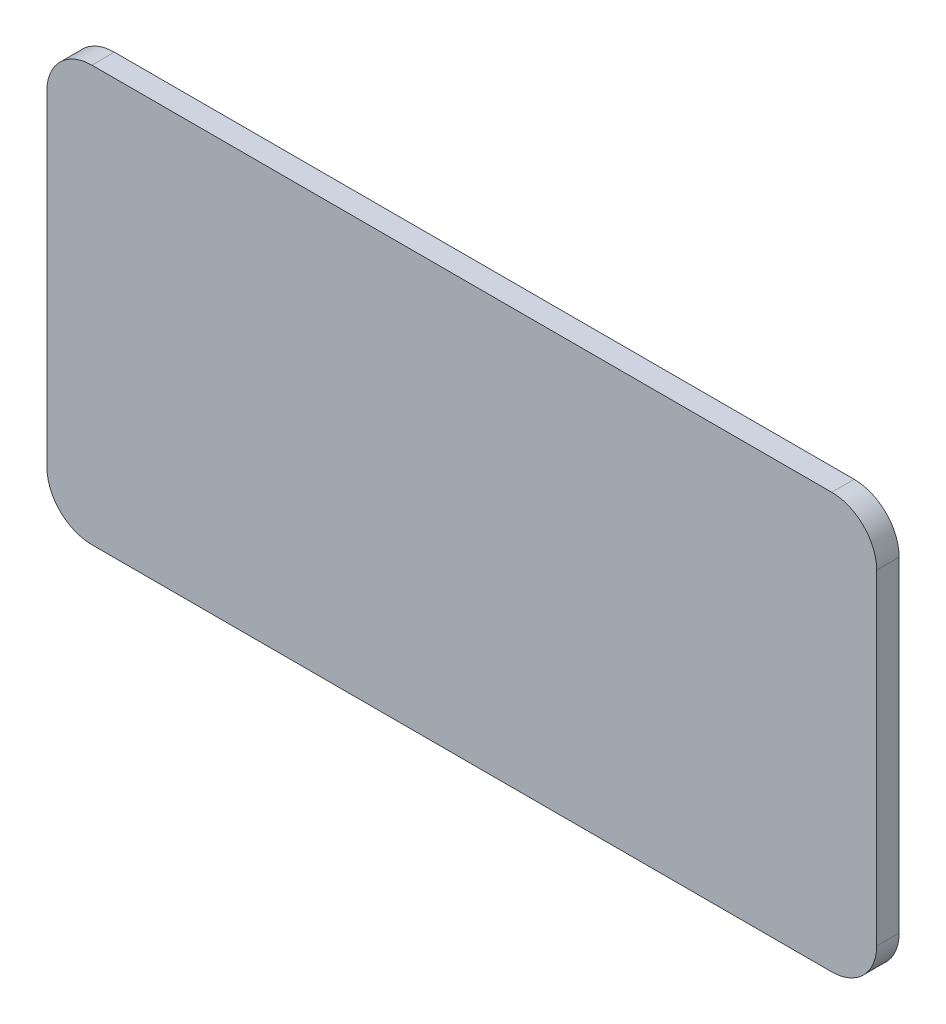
SolidWorks part; units mm, degrees
ref_plane "Plan de face" through (0, 0, 0) normal (0, 0, 1) x (1, 0, 0)
ref_plane "Plan de dessus" through (0, 0, 0) normal (0, 1, 0) x (1, 0, 0)
ref_plane "Plan de droite" through (0, 0, 0) normal (1, 0, 0) x (0, 0, -1)
sketch "Esquisse1" plane through (0, 0, 0) normal (0, 0, 1) x (1, 0, 0)
  line L0 (73.15, 129.1) -> (88.9982, 129.1) construction
  line L2 (78.15, 152.2) -> (-4.15, 152.2)
  line L3 (83.15, 147.2) -> (83.15, 111)
  line L4 (78.15, 106) -> (-4.15, 106)
  line L5 (-9.15, 147.2) -> (-9.15, 111)
  line L15 (0.85, 142.2) -> (73.15, 142.2) construction
  line L16 (0.85, 142.2) -> (0.85, 116) construction
  line L17 (0.85, 116) -> (73.15, 116) construction
  line L18 (73.15, 142.2) -> (73.15, 116) construction
  line L49 (37, 142.2) -> (37, 155.2645) construction
  arc A0 (78.15, 152.2) -> (83.15, 147.2) centre (78.15, 147.2) cw
  arc A1 (83.15, 111) -> (78.15, 106) centre (78.15, 111) cw
  arc A2 (-4.15, 106) -> (-9.15, 111) centre (-4.15, 111) cw
  arc A3 (-4.15, 152.2) -> (-9.15, 147.2) centre (-4.15, 147.2) ccw
  dimension "D5" = 5
  dimension "D1" = 10
  dimension "D2" = 10
  dimension "D3" = 10
  dimension "D4" = 10
extrude "Boss.-Extru.1" add sketch "Esquisse1" along normal blind 6
sketch "Esquisse2" plane through (0, 0, 0) normal (0, 0, -1) x (-1, 0, 0)
  line L0 (9.15, 129.1) -> (-43.8923, 129.1) construction
  line L1 (9.15, 147.2) -> (9.15, 111) construction
  line L2 (-37, 152.2) -> (-37, 127.8563) construction
  line L3 (-78.15, 152.2) -> (4.15, 152.2) construction
  line L5 (-72.15, 116) -> (-1.85, 116)
  line L6 (-73.15, 117) -> (-73.15, 141.2)
  line L7 (-72.15, 142.2) -> (-1.85, 142.2)
  line L8 (-0.85, 117) -> (-0.85, 141.2)
  line L9 (-73.15, 116) -> (-0.85, 142.2) construction
  line L10 (-73.15, 142.2) -> (-0.85, 116) construction
  line L12 (10.4589, 153.8873) -> (-84.4589, 153.8873)
  line L13 (10.4589, 153.8873) -> (10.4589, 104.3127)
  line L14 (10.4589, 104.3127) -> (-84.4589, 104.3127)
  line L15 (-84.4589, 153.8873) -> (-84.4589, 104.3127)
  line L16 (10.4589, 153.8873) -> (-84.4589, 104.3127) construction
  line L17 (10.4589, 104.3127) -> (-84.4589, 153.8873) construction
  arc A0 (-1.85, 142.2) -> (-0.85, 141.2) centre (-1.85, 141.2) cw
  arc A1 (-1.85, 116) -> (-0.85, 117) centre (-1.85, 117) ccw
  arc A2 (-72.15, 116) -> (-73.15, 117) centre (-72.15, 117) cw
  arc A3 (-73.15, 141.2) -> (-72.15, 142.2) centre (-72.15, 141.2) cw
  point P8 (-37, 129.1)
  point P25 (-37, 129.1)
  dimension "D3" = 1
  dimension "D1" = 10
  dimension "D2" = 10
extrude "Enlèv. mat.-Extru.1" cut sketch "Esquisse2" against normal blind 3.5
